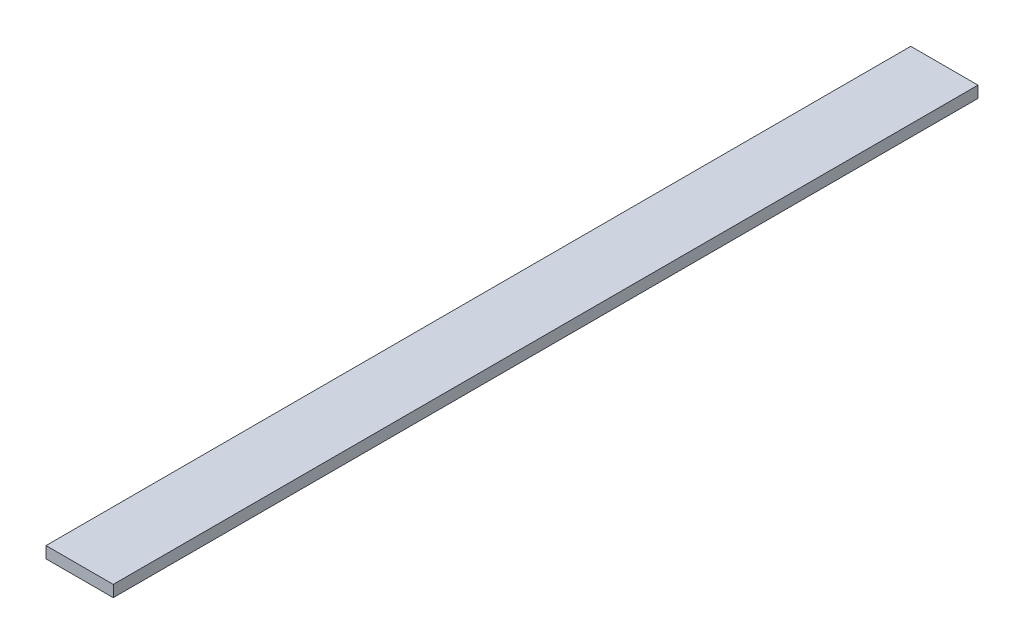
SolidWorks part; units mm, degrees
ref_plane "Alzado" through (0, 0, 0) normal (0, 0, 1) x (1, 0, 0)
ref_plane "Planta" through (0, 0, 0) normal (0, 1, 0) x (1, 0, 0)
ref_plane "Vista lateral" through (0, 0, 0) normal (1, 0, 0) x (0, 0, -1)
sketch "Croquis1" plane through (0, 0, 0) normal (0, 0, 1) x (1, 0, 0)
  line L0 (17.5, 3) -> (-17.5, -3) construction
  line L1 (-17.5, 3) -> (17.5, 3)
  line L2 (-17.5, 3) -> (-17.5, -3)
  line L3 (-17.5, -3) -> (17.5, -3)
  line L4 (17.5, 3) -> (17.5, -3)
extrude "Extruir1" add sketch "Croquis1" along normal mid plane 450
